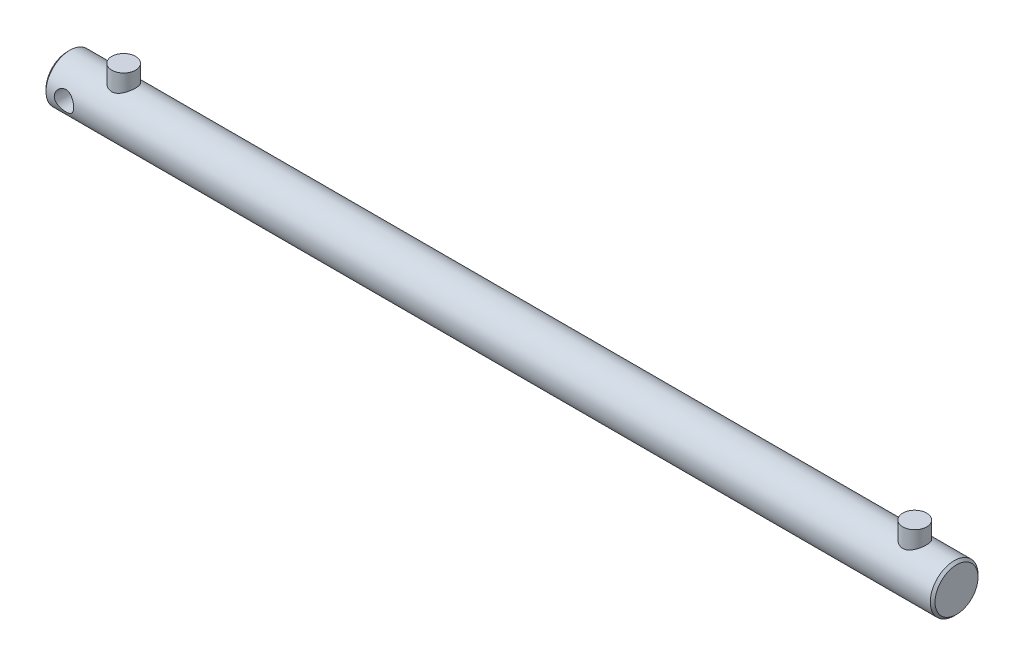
SolidWorks part; units mm, degrees
ref_plane "Plan de face" through (0, 0, 0) normal (0, 0, 1) x (1, 0, 0)
ref_plane "Plan de dessus" through (0, 0, 0) normal (0, 1, 0) x (1, 0, 0)
ref_plane "Plan de droite" through (0, 0, 0) normal (1, 0, 0) x (0, 0, -1)
sketch "Esquisse1" plane through (0, 0, 0) normal (0, 0, 1) x (1, 0, 0)
  line L0 (-372, 0) -> (372, 0) construction
  line L1 (-372, 0) -> (-372, 20)
  line L2 (-372, 20) -> (372, 20)
  line L3 (372, 20) -> (372, 0)
  line L6 (-372, 0) -> (372, 0)
  dimension "D1" = 40
  dimension "D3" = 744
revolve "Révolution1" add sketch "Esquisse1" angle 360 about L0
chamfer "Chanfrein1" distance 2 angle 45 2 edges at (372, 0, 20) (-372, 0, 20)
sketch "Esquisse3" plane through (0, 0, 0) normal (0, 0, 1) x (1, 0, 0)
  line L0 (-372, 18) -> (-372, -18) construction
  circle A0 centre (-355, 0) radius 8.1
  dimension "D1" = 16.2
  dimension "D2" = 17
extrude "Enlèv. mat.-Extru.1" cut sketch "Esquisse3" against normal through all and the other way through all
sketch "Esquisse5" plane through (0, 0, 0) normal (0, 1, 0) x (1, 0, 0)
  line L0 (-372, 18) -> (-372, -18) construction
  line L1 (372, -18) -> (372, 18) construction
  circle A0 centre (-325, 0) radius 10
  circle A1 centre (337, 0) radius 10
  dimension "D1" = 20
  dimension "D2" = 47
  dimension "D3" = 35
extrude "Extrusion2" add sketch "Esquisse5" along normal blind 33
